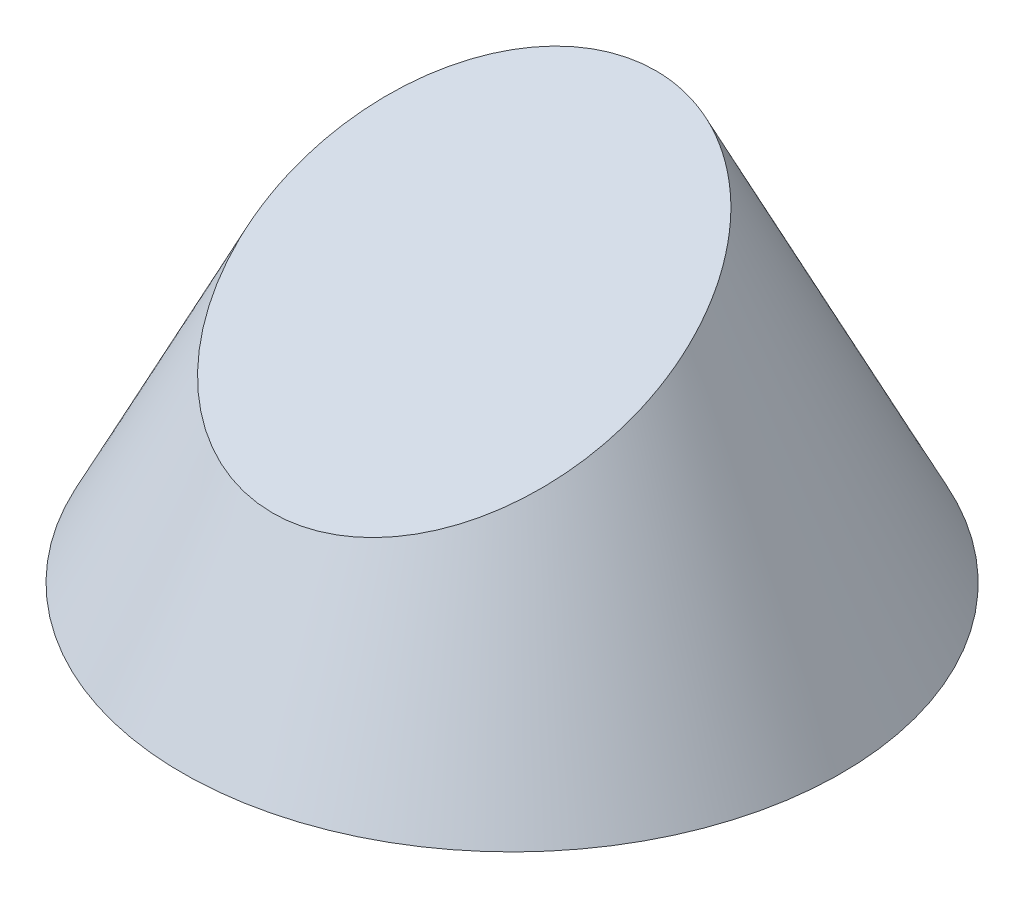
SolidWorks part; units mm, degrees
ref_plane "前视基准面" through (0, 0, 0) normal (0, 0, 1) x (1, 0, 0)
ref_plane "上视基准面" through (0, 0, 0) normal (0, 1, 0) x (1, 0, 0)
ref_plane "右视基准面" through (0, 0, 0) normal (1, 0, 0) x (0, 0, -1)
sketch "草图1" plane through (0, 0, 0) normal (1, 0, 0) x (0, 0, -1)
  line L0 (0, 0) -> (0, 36.1647) construction
  line L1 (0, 0) -> (20, 0)
  line L2 (20, 0) -> (0, 40)
  line L3 (0, 40) -> (0, 0)
  dimension "D1" = 20
  dimension "D2" = 40
revolve "旋转1" add sketch "草图1" angle 360 about L0
sketch "草图3" plane through (0, 0, 0) normal (1, 0, 0) x (0, 0, -1)
  line L0 (-14.5323, 10.9354) -> (8.7194, 22.5612)
  line L1 (0, 40) -> (-20, 0) construction
  line L2 (20, 0) -> (0, 40) construction
  line L3 (-14.5323, 10.9354) -> (-14.5323, 45.2244)
  line L4 (-14.5323, 45.2244) -> (8.7194, 45.2244)
  line L5 (8.7194, 45.2244) -> (8.7194, 22.5612)
extrude "切除-拉伸1" cut sketch "草图3" against normal through all both and the other way through all
